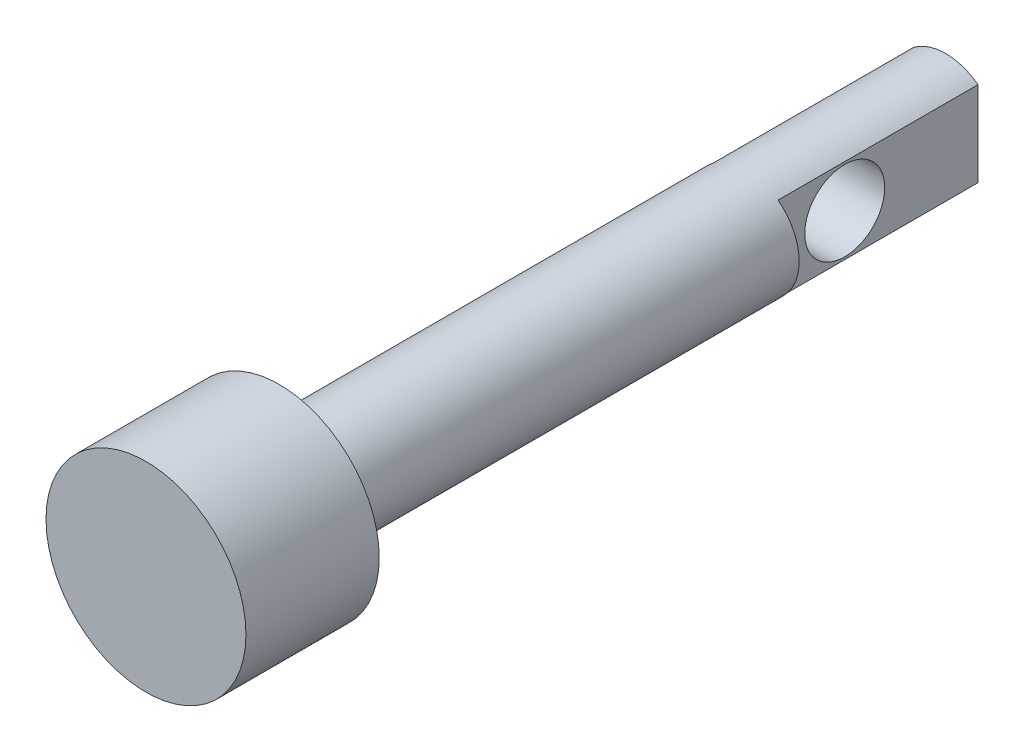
SolidWorks part; units mm, degrees
ref_plane "Plano frontal" through (0, 0, 0) normal (0, 0, 1) x (1, 0, 0)
ref_plane "Plano superior" through (0, 0, 0) normal (0, 1, 0) x (1, 0, 0)
ref_plane "Plano direito" through (0, 0, 0) normal (1, 0, 0) x (0, 0, -1)
sketch "Esboço1" plane through (0, 0, 0) normal (1, 0, 0) x (0, 0, -1)
  line L0 (-60, 0) -> (60, 0)
  line L1 (-60, 0) -> (-60, 15)
  line L2 (-60, 15) -> (-40, 15)
  line L3 (-40, 15) -> (-40, 8)
  line L4 (-40, 8) -> (60, 8)
  line L5 (60, 8) -> (60, 0)
  dimension "D1" = 120
  dimension "D2" = 20
  dimension "D3" = 15
  dimension "D4" = 8
revolve "Revolução1" add sketch "Esboço1" angle 360 about L0
sketch "Esboço2" plane through (0, 0, 0) normal (1, 0, 0) x (0, 0, -1)
  circle A0 centre (40, 0) radius 6
  dimension "D1" = 12
  dimension "D2" = 40
extrude "Corte-extrusão1" cut sketch "Esboço2" against normal through all both and the other way through all
sketch "Esboço3" plane through (0, 0, -60) normal (0, 0, -1) x (-1, 0, 0)
  line L1 (-4.8391, 6.3705) -> (4.8391, 6.3705)
  line L2 (-4.8391, 6.3705) -> (-4.8391, -6.3705)
  line L3 (-4.8391, -6.3705) -> (4.8391, -6.3705)
  line L4 (4.8391, 6.3705) -> (4.8391, -6.3705)
  circle A0 centre (0, 0) radius 8 construction
  circle A1 centre (0, 0) radius 8
  circle A2 centre (0, 0) radius 8
  circle A3 centre (0, 0) radius 8 construction
  dimension "D1" = 0
extrude "Corte-extrusão2" cut sketch "Esboço3" against normal blind 30 contours L2 M6 | L4 M6
